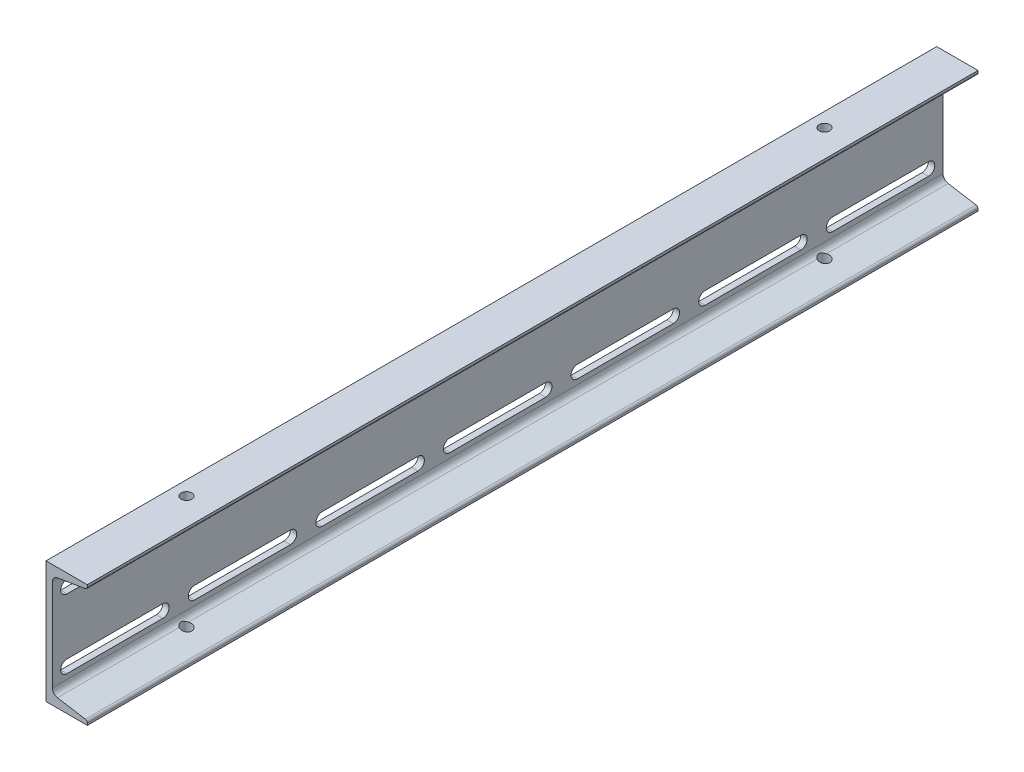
SolidWorks part; units mm, degrees
ref_plane "Front Plane" through (0, 0, 0) normal (0, 0, 1) x (1, 0, 0)
ref_plane "Top Plane" through (0, 0, 0) normal (0, 1, 0) x (1, 0, 0)
ref_plane "Right Plane" through (0, 0, 0) normal (1, 0, 0) x (0, 0, -1)
ref_plane "beam cntr 1" through (0, 0, 558.5883) normal (0, 0, 1) x (1, 0, 0)
ref_plane "beam cntr 2" through (0, 0, -558.5883) normal (0, 0, 1) x (1, 0, 0)
sketch "Sketch1" plane through (0, 0, 0) normal (0, 0, 1) x (1, 0, 0)
  point P5 (-4.708, 0)
  line B0 (-12.6836, -76.2) -> (-12.6836, 76.2)
  line B1 (-12.6836, 76.2) -> (38.98, 76.2)
  line B2 (-12.6836, -76.2) -> (38.98, -76.2)
  line B3 (11.6879, -67.4878) -> (-13.7121, -67.4878) construction
  line B4 (-4.708, 57.3918) -> (-4.708, -57.3918)
  line B5 (38.98, 76.2) -> (38.98, 73.7107)
  line B6 (38.98, -76.2) -> (38.98, -73.7107)
  line B7 (1.6592, 64.9081) -> (36.4332, 70.7042)
  line B8 (1.6592, -64.9081) -> (36.4332, -70.7042)
  arc B9 (-4.708, -57.3918) -> (1.6592, -64.9081) centre (2.912, -57.3918) ccw
  arc B10 (-4.708, 57.3918) -> (1.6592, 64.9081) centre (2.912, 57.3918) cw
  arc B11 (38.98, 73.7107) -> (36.4332, 70.7042) centre (35.932, 73.7107) cw
  arc B12 (38.98, -73.7107) -> (36.4332, -70.7042) centre (35.932, -73.7107) ccw
sketch_block_instance "C6x10.5-1"
sketch_block "C6x10.5" parameters "D3"=7.62, "D6"=3.048, "D1"=152.4, "D2"=51.6636, "D4"=7.9756, "D5"=9.463, "D7"=2.4893, "D8"=8.7122, "D9"=12.6836
extrude "Boss-Extrude1" add sketch "Sketch1" along normal mid plane 1114.0017
sketch "Sketch2" plane through (-4.708, 0, 0) normal (1, 0, 0) x (0, 0, -1)
  line L0 (-538.6917, 43.18) -> (-418.8883, 43.18) construction
  line L9 (-538.6917, 51.1175) -> (-418.8883, 51.1175)
  line L19 (-538.6917, 35.2425) -> (-418.8883, 35.2425)
  line L23 (-379.095, 43.18) -> (-259.2917, 43.18) construction
  line L30 (-538.6917, -43.18) -> (-418.8883, -43.18) construction
  line L31 (-538.6917, -35.2425) -> (-418.8883, -35.2425)
  line L32 (-538.6917, -51.1175) -> (-418.8883, -51.1175)
  line L33 (-379.095, 51.1175) -> (-259.2917, 51.1175)
  line L36 (-478.79, 43.18) -> (-478.79, -43.18) construction
  line L37 (-379.095, 35.2425) -> (-259.2917, 35.2425)
  line L38 (-558.5883, 28.415) -> (-558.5883, -28.415) construction
  line L40 (-379.095, -43.18) -> (-259.2917, -43.18) construction
  line L41 (-379.095, -35.2425) -> (-259.2917, -35.2425)
  line L42 (-379.095, -51.1175) -> (-259.2917, -51.1175)
  line L43 (-219.4983, 43.18) -> (-99.695, 43.18) construction
  line L44 (-219.4983, 51.1175) -> (-99.695, 51.1175)
  line L45 (-219.4983, 35.2425) -> (-99.695, 35.2425)
  line L46 (-219.4983, -43.18) -> (-99.695, -43.18) construction
  line L47 (-219.4983, -35.2425) -> (-99.695, -35.2425)
  line L48 (-219.4983, -51.1175) -> (-99.695, -51.1175)
  line L49 (-59.9017, 43.18) -> (59.9017, 43.18) construction
  line L50 (-59.9017, 51.1175) -> (59.9017, 51.1175)
  line L51 (-59.9017, 35.2425) -> (59.9017, 35.2425)
  line L52 (-59.9017, -43.18) -> (59.9017, -43.18) construction
  line L53 (-59.9017, -35.2425) -> (59.9017, -35.2425)
  line L54 (-59.9017, -51.1175) -> (59.9017, -51.1175)
  line L55 (99.695, 43.18) -> (219.4983, 43.18) construction
  line L56 (99.695, 51.1175) -> (219.4983, 51.1175)
  line L57 (99.695, 35.2425) -> (219.4983, 35.2425)
  line L58 (99.695, -43.18) -> (219.4983, -43.18) construction
  line L59 (99.695, -35.2425) -> (219.4983, -35.2425)
  line L60 (99.695, -51.1175) -> (219.4983, -51.1175)
  line L61 (259.2917, 43.18) -> (379.095, 43.18) construction
  line L62 (259.2917, 51.1175) -> (379.095, 51.1175)
  line L63 (259.2917, 35.2425) -> (379.095, 35.2425)
  line L64 (259.2917, -43.18) -> (379.095, -43.18) construction
  line L65 (259.2917, -35.2425) -> (379.095, -35.2425)
  line L66 (259.2917, -51.1175) -> (379.095, -51.1175)
  line L67 (418.8883, 43.18) -> (538.6917, 43.18) construction
  line L68 (418.8883, 51.1175) -> (538.6917, 51.1175)
  line L69 (418.8883, 35.2425) -> (538.6917, 35.2425)
  line L70 (418.8883, -43.18) -> (538.6917, -43.18) construction
  line L71 (418.8883, -35.2425) -> (538.6917, -35.2425)
  line L72 (418.8883, -51.1175) -> (538.6917, -51.1175)
  arc A24 (-538.6917, 51.1175) -> (-538.6917, 35.2425) centre (-538.6917, 43.18) ccw
  arc A25 (-418.8883, 35.2425) -> (-418.8883, 51.1175) centre (-418.8883, 43.18) ccw
  arc A28 (-538.6917, -35.2425) -> (-538.6917, -51.1175) centre (-538.6917, -43.18) ccw
  arc A29 (-418.8883, -51.1175) -> (-418.8883, -35.2425) centre (-418.8883, -43.18) ccw
  arc A32 (-379.095, 51.1175) -> (-379.095, 35.2425) centre (-379.095, 43.18) ccw
  arc A33 (-259.2917, 35.2425) -> (-259.2917, 51.1175) centre (-259.2917, 43.18) ccw
  arc A34 (-379.095, -35.2425) -> (-379.095, -51.1175) centre (-379.095, -43.18) ccw
  arc A35 (-259.2917, -51.1175) -> (-259.2917, -35.2425) centre (-259.2917, -43.18) ccw
  arc A36 (-219.4983, 51.1175) -> (-219.4983, 35.2425) centre (-219.4983, 43.18) ccw
  arc A37 (-99.695, 35.2425) -> (-99.695, 51.1175) centre (-99.695, 43.18) ccw
  arc A38 (-219.4983, -35.2425) -> (-219.4983, -51.1175) centre (-219.4983, -43.18) ccw
  arc A39 (-99.695, -51.1175) -> (-99.695, -35.2425) centre (-99.695, -43.18) ccw
  arc A40 (-59.9017, 51.1175) -> (-59.9017, 35.2425) centre (-59.9017, 43.18) ccw
  arc A41 (59.9017, 35.2425) -> (59.9017, 51.1175) centre (59.9017, 43.18) ccw
  arc A42 (-59.9017, -35.2425) -> (-59.9017, -51.1175) centre (-59.9017, -43.18) ccw
  arc A43 (59.9017, -51.1175) -> (59.9017, -35.2425) centre (59.9017, -43.18) ccw
  arc A44 (99.695, 51.1175) -> (99.695, 35.2425) centre (99.695, 43.18) ccw
  arc A45 (219.4983, 35.2425) -> (219.4983, 51.1175) centre (219.4983, 43.18) ccw
  arc A46 (99.695, -35.2425) -> (99.695, -51.1175) centre (99.695, -43.18) ccw
  arc A47 (219.4983, -51.1175) -> (219.4983, -35.2425) centre (219.4983, -43.18) ccw
  arc A48 (259.2917, 51.1175) -> (259.2917, 35.2425) centre (259.2917, 43.18) ccw
  arc A49 (379.095, 35.2425) -> (379.095, 51.1175) centre (379.095, 43.18) ccw
  arc A50 (259.2917, -35.2425) -> (259.2917, -51.1175) centre (259.2917, -43.18) ccw
  arc A51 (379.095, -51.1175) -> (379.095, -35.2425) centre (379.095, -43.18) ccw
  arc A52 (418.8883, 51.1175) -> (418.8883, 35.2425) centre (418.8883, 43.18) ccw
  arc A53 (538.6917, 35.2425) -> (538.6917, 51.1175) centre (538.6917, 43.18) ccw
  arc A54 (418.8883, -35.2425) -> (418.8883, -51.1175) centre (418.8883, -43.18) ccw
  arc A55 (538.6917, -51.1175) -> (538.6917, -35.2425) centre (538.6917, -43.18) ccw
  point P2 (-478.79, 43.18)
  point P9 (-319.1933, 43.18)
  point P18 (-478.79, -43.18)
  point P25 (-319.1933, -43.18)
  point P32 (-478.79, 0)
  point P35 (-159.5967, 43.18)
  point P44 (-159.5967, -43.18)
  point P49 (0, 43.18)
  point P60 (0, -43.18)
  point P65 (159.5967, 43.18)
  point P74 (159.5967, -43.18)
  point P79 (319.1933, 43.18)
  point P88 (319.1933, -43.18)
  point P93 (478.79, 43.18)
  point P102 (478.79, -43.18)
  dimension "D1" = 86.36
  dimension "D2" = 7.9375
  dimension "D3" = 7.9375
  dimension "D4" = 19.8967
  dimension "D5" = 7
  dimension "D6" = 119.8033
extrude "Cut-Extrude1" cut sketch "Sketch2" against normal blind 25.4
sketch "Sketch3" plane through (0, 0, 0) normal (0, 1, 0) x (1, 0, 0)
  line L0 (-12.6836, -557.0008) -> (-12.6836, 557.0008) construction
  circle A0 centre (4.9758, 398.9917) radius 6.7469
  circle A1 centre (4.9758, -398.9917) radius 6.7469
  dimension "D3" = 13.4937
  dimension "D4" = 13.4937
  dimension "D1" = 398.9917
  dimension "D2" = 398.9917
  dimension "D5" = 17.6593
extrude "Cut-Extrude2" cut sketch "Sketch3" against normal through all both and the other way through all
